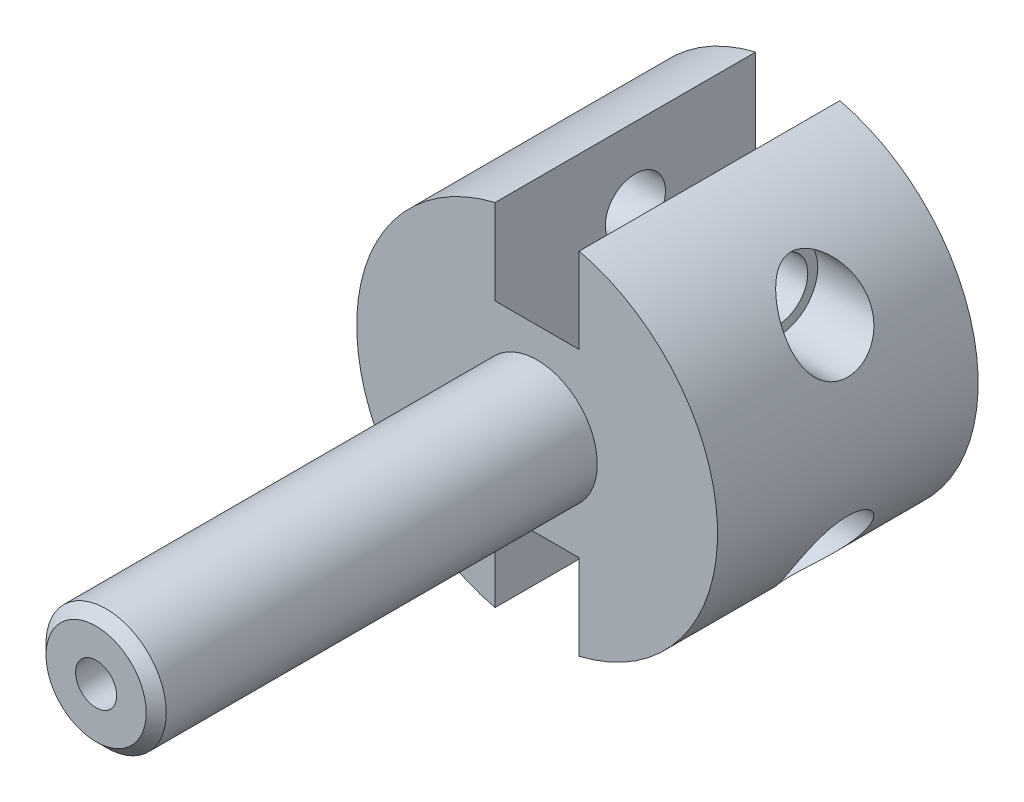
SolidWorks part; units mm, degrees
ref_plane "Face" through (0, 0, 0) normal (0, 0, 1) x (1, 0, 0)
ref_plane "Dessus" through (0, 0, 0) normal (0, 1, 0) x (1, 0, 0)
ref_plane "Droite" through (0, 0, 0) normal (1, 0, 0) x (0, 0, -1)
sketch "Esquisse1" plane through (0, 0, 0) normal (0, 0, 1) x (1, 0, 0)
  circle A0 centre (0, 0) radius 9
  dimension "D1" = 18
extrude "Extrusion1" add sketch "Esquisse1" along normal blind 13
sketch "Esquisse2" plane through (0, 0, 13) normal (0, 0, 1) x (1, 0, 0)
  circle A0 centre (0, 0) radius 3
  dimension "D1" = 6
extrude "Extrusion2" add sketch "Esquisse2" along normal blind 22
chamfer "Chanfrein1" distance 0.5 angle 45
sketch "Esquisse3" plane through (0, 0, 0) normal (1, 0, 0) x (0, 0, -1)
  line L0 (-13, 9) -> (-13, -9) construction
  line L1 (-13, 9) -> (-13, 4.5)
  line L2 (0, 0) -> (-23.6331, 0) construction
  line L3 (-13, 9) -> (1.2702, 9)
  line L4 (1.2702, 9) -> (1.2702, -9)
  line L5 (1.2702, -9) -> (-13, -9)
  line L6 (-13, -4.5) -> (-13, -9)
  arc A0 (-13, -4.5) -> (-13, 4.5) centre (-19, 0) ccw
  dimension "D1" = 15
  dimension "D2" = 6
extrude "Enlèv. mat.-Extru.1" cut sketch "Esquisse3" against normal mid plane 4.2
sketch "Esquisse4" plane through (0, 0, 0) normal (1, 0, 0) x (0, 0, -1)
  line L0 (-6, 13.7031) -> (-6, -12.1388) construction
  line L1 (0, -8.7516) -> (0, 8.7516) construction
  circle A0 centre (-6, 5) radius 1.5
  circle A1 centre (-6, -5) radius 1.5
  dimension "D2" = 10
  dimension "D4" = 3
  dimension "D1" = 6
  dimension "D3" = 5
extrude "Enlèv. mat.-Extru.2" cut sketch "Esquisse4" against normal through all and the other way through all
ref_plane "Plan1" through (5, 0, 0) normal (1, 0, 0) x (0, 0, -1)
sketch "Esquisse5" plane through (5, 0, 0) normal (1, 0, 0) x (0, 0, -1)
  circle A0 centre (-6, 5) radius 2
  circle A1 centre (-6, -5) radius 2
  dimension "D1" = 4
extrude "Enlèv. mat.-Extru.3" cut sketch "Esquisse5" along normal blind 4.2
hole_wizard "Trou taraudé M2.5x0.451" positions "Esquisse7" profile "Esquisse6" tap size "M2.5x0.45" standard "ISO"
sketch "Esquisse7" plane through (0, 0, 35) normal (0, 0, 1) x (1, 0, 0)
  circle A1 centre (0, 0) radius 2.5 construction
  point P0 (0, 0)
sketch "Esquisse6" plane through (0, 0, 35) normal (1, 0, 0) x (0, -1, 0)
  line L0 (0, 0) -> (0, 7.8659)
  line L1 (0, 7.8659) -> (1.025, 7.25)
  line L2 (1.025, 7.25) -> (1.025, 0)
  line L5 (1.025, 0) -> (0, 0)
  line L10 (0, 7.8659) -> (-1.025, 7.25) construction
  line L11 (0, -6.35) -> (0, 107.95) construction
  dimension "Diamètre du trou pour taraudage" = 2.05
  dimension "Profondeur du trou pour taraudage" = 7.25
  dimension "Angle de pointe" = 118
hole_wizard "Trou taraudé M3x0.52" positions "Esquisse9" profile "Esquisse8" tap size "M3x0.5" standard "ISO"
sketch "Esquisse9" plane through (0, 0, 0) normal (0, 0, -1) x (-1, 0, 0)
  line L0 (11.3814, 0) -> (-10.1359, 0) construction
  point P0 (-5.5, 0)
  point P1 (5.5, 0)
  dimension "D1" = 11
  dimension "D2" = 5.5
sketch "Esquisse8" plane through (5.5, 0, 0) normal (1, 0, 0) x (0, 1, 0)
  line L0 (0, 0) -> (0, 11.221)
  line L1 (0, 11.221) -> (1.2, 10.5)
  line L2 (1.2, 10.5) -> (1.2, 0)
  line L5 (1.2, 0) -> (0, 0)
  line L10 (0, 11.221) -> (-1.2, 10.5) construction
  line L11 (0, -6.35) -> (0, 107.95) construction
  dimension "Diamètre du trou pour taraudage" = 2.4
  dimension "Profondeur du trou pour taraudage" = 10.5
  dimension "Angle de pointe" = 118
